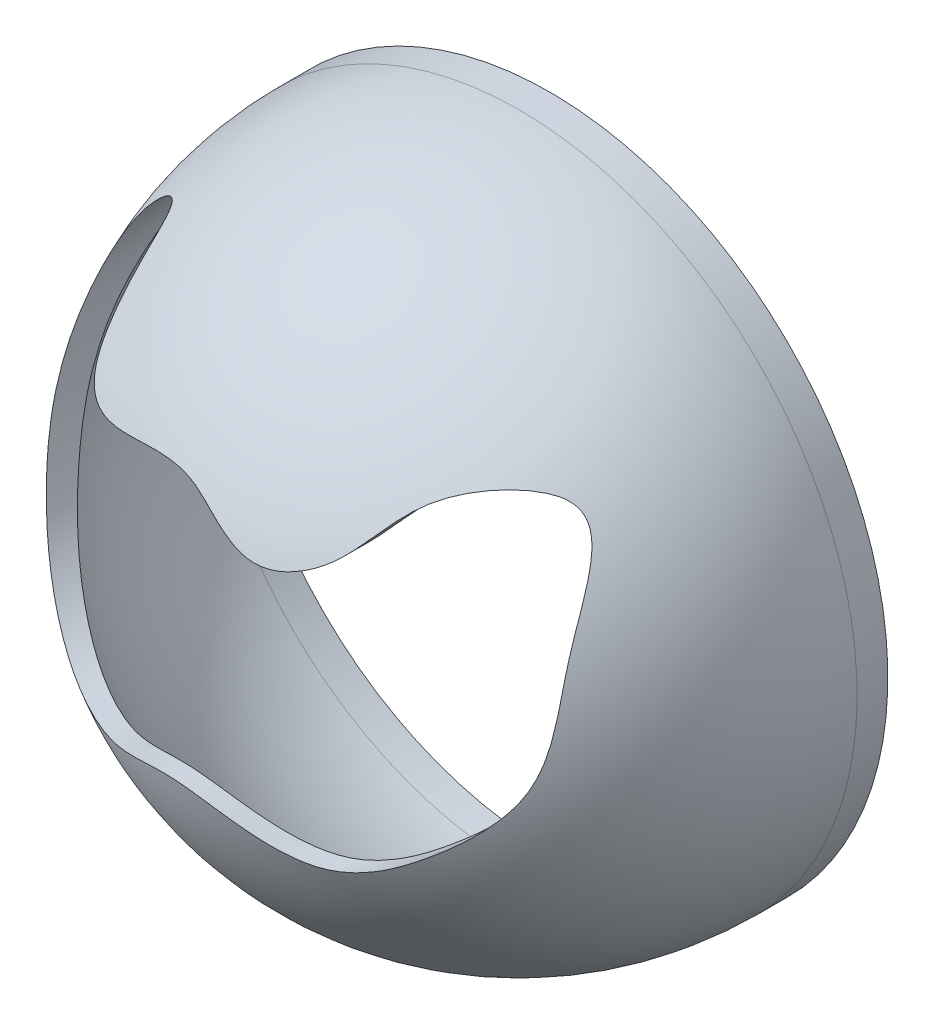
SolidWorks part; units mm, degrees
ref_plane "Front Plane" through (0, 0, 0) normal (0, 0, 1) x (1, 0, 0)
ref_plane "Top Plane" through (0, 0, 0) normal (0, 1, 0) x (1, 0, 0)
ref_plane "Right Plane" through (0, 0, 0) normal (1, 0, 0) x (0, 0, -1)
sketch "Sketch2" plane through (0, 0, 0) normal (1, 0, 0) x (0, 0, -1)
  line L7 (90.5803, 0) -> (147.5803, 0)
  line L8 (147.5803, 0) -> (147.5803, 52)
  line L9 (147.5803, 52) -> (142.5803, 52)
  line L10 (142.5803, 52) -> (142.5803, 0) construction
  line L11 (90.5803, 0) -> (46.7658, 0) construction
  arc A1 (142.5803, 52) -> (90.5803, 0) centre (142.5803, 0) ccw
  dimension "D4" = 52
  dimension "D3" = 5
revolve "Revolve1" add sketch "Sketch2" angle 360 about L11
shell "Shell1" thickness 3
sketch "Sketch5" plane through (0, 0, 0) normal (0, 1, 0) x (1, 0, 0)
  line L0 (-55, 147.5803) -> (55, 147.5803) construction
  line L1 (55, 147.5803) -> (-55, 147.5803) construction
  line L2 (0, 147.5803) -> (0, 100.0199) construction
  line L4 (-32, 147.5803) -> (32, 147.5803)
  line L5 (-32, 147.5803) -> (-32, 106.5803)
  line L6 (-32, 106.5803) -> (32, 106.5803)
  line L7 (32, 147.5803) -> (32, 106.5803)
  point P12 (0, 147.5803)
  dimension "D1" = 64
  dimension "D2" = 41
ref_plane "Plane1" through (0, 0, -67.5803) normal (0, 0, -1) x (-1, 0, 0)
ref_plane "Plane2" through (0, 0, -147.5803) normal (0, 0, 1) x (1, 0, 0)
ref_plane "Plane3" through (0, 0, -147.5803) normal (0, 0, -1) x (-1, 0, 0)
sketch "Sketch9" plane through (0, 0, -67.5803) normal (0, 0, -1) x (-1, 0, 0)
  line L0 (-55.6458, -11.9943) -> (52.3542, -11.9943) construction
  spline S0 degree 3 poles (44.8161, 28.0236) (28.7277, 42.6743) (32.54, 20.2387) (15.8788, 24.1621) (4.2119, 27.0484) (-6.5106, 18.0686) (-18.3342, 22.6851) (-23.1434, 32.6857) (-39.6569, 33.7699) (-41.598, 14.1347) (-41.9669, -2.745) (-29.8368, -13.8632) (-17.2043, -21.4083) (-6.0413, -16.0953) (5.6294, -13.1484) (17.3221, -19.5249) (33.3647, -17.5828) (45.6329, -4.5882) (45.83, 14.0305) (44.8161, 28.0236) (28.7277, 42.6743) (32.54, 20.2387) knots -0.180304 -0.109918 -0.040571 0 0.051097 0.09419 0.148468 0.194376 0.235839 0.274592 0.317068 0.383104 0.457294 0.510351 0.565253 0.613192 0.644405 0.701513 0.757417 0.819696 0.890082 0.959429 1 1.051097 1.09419 1.148468 only from (32.0815, 37.0933) to (32.0815, 37.0933)
extrude "Cut-Extrude1" cut sketch "Sketch9" along normal blind 70
